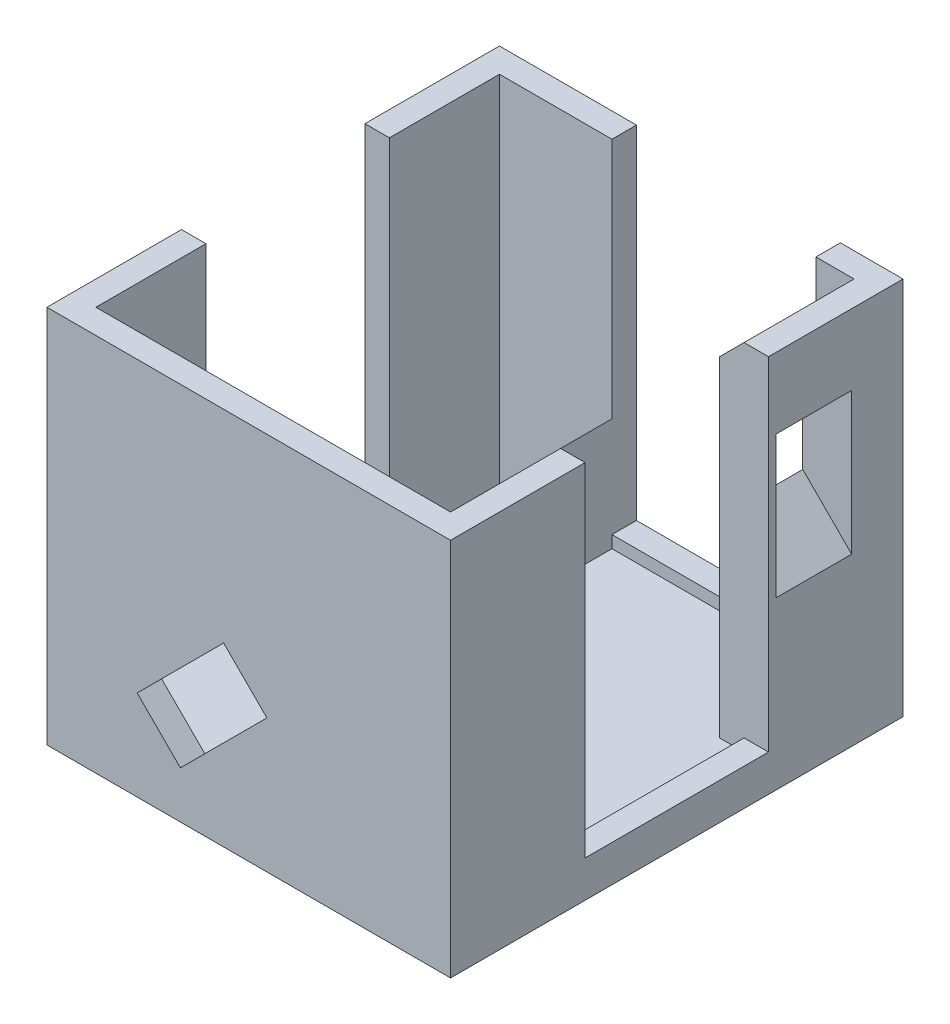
SolidWorks part; units mm, degrees
ref_plane "Front Plane" through (0, 0, 0) normal (0, 0, 1) x (1, 0, 0)
ref_plane "Top Plane" through (0, 0, 0) normal (0, 1, 0) x (1, 0, 0)
ref_plane "Right Plane" through (0, 0, 0) normal (1, 0, 0) x (0, 0, -1)
sketch "Sketch1" plane through (0, 0, 0) normal (0, 1, 0) x (1, 0, 0)
  line L1 (-29, 33) -> (29, 33)
  line L2 (-29, 33) -> (-29, -33)
  line L3 (-29, -33) -> (29, -33)
  line L4 (29, 33) -> (29, -33)
  line L5 (-29, 33) -> (29, -33) construction
  line L6 (-29, -33) -> (29, 33) construction
  line L7 (-33, 37) -> (33, 37)
  line L8 (-33, 37) -> (-33, -37)
  line L9 (-33, -37) -> (33, -37)
  line L10 (33, 37) -> (33, -37)
  line L11 (-33, 37) -> (33, -37) construction
  line L12 (-33, -37) -> (33, 37) construction
  point P0 (0, 0)
  point P6 (0, 0)
  dimension "D1" = 58
  dimension "D2" = 66
  dimension "D3" = 4
  dimension "D4" = 4
extrude "Boss-Extrude1" add sketch "Sketch1" along normal blind 58
sketch "Sketch2" plane through (0, 0, 0) normal (0, -1, 0) x (1, 0, 0)
  line L1 (-33, -37) -> (33, -37)
  line L2 (-33, -37) -> (-33, 37)
  line L3 (-33, 37) -> (33, 37)
  line L4 (33, -37) -> (33, 37)
  line L5 (-33, -37) -> (33, 37) construction
  line L6 (-33, 37) -> (33, -37) construction
  point P0 (0, 0)
extrude "Boss-Extrude2" add sketch "Sketch2" along normal blind 4
sketch "Sketch7" plane through (0, 0, 37) normal (0, 0, 1) x (1, 0, 0)
  line L0 (-29, 0) -> (29, 0)
  line L2 (-33, 58) -> (-33, -4) construction
  line L3 (-29, 0) -> (29, 58)
  line L6 (33, 58) -> (33, -4) construction
  line L7 (29, 58) -> (29, 0)
  dimension "D1" = 4
  dimension "D2" = 45
  dimension "D3" = 4
  dimension "D4" = 4
extrude "Boss-Extrude4" add sketch "Sketch7" against normal blind 70
sketch "Sketch9" plane through (-14.5, 14.5, 0) normal (-0.7071, 0.7071, 0) x (0, 0, 1)
  line L2 (-33, 61.5183) -> (-33, -20.5061) construction
  line L3 (-28.6, 56.1593) -> (-16.2, 56.1593)
  line L4 (-28.6, 56.1593) -> (-28.6, 39.7593)
  line L5 (-28.6, 39.7593) -> (-16.2, 39.7593)
  line L6 (-16.2, 56.1593) -> (-16.2, 39.7593)
  line L7 (-28.6, 56.1593) -> (-16.2, 39.7593) construction
  line L8 (-28.6, 39.7593) -> (-16.2, 56.1593) construction
  dimension "D1" = 12.4
  dimension "D2" = 16.4
  dimension "D3" = 4.4
extrude "Cut-Extrude3" cut sketch "Sketch9" against normal blind 30
sketch "Sketch11" plane through (0, 0, 37) normal (0, 0, 1) x (1, 0, 0)
  line L0 (-29, 0) -> (-2.6603, 0)
  line L1 (-29, 0) -> (-18.252, 10.748)
  line L2 (-33, 58) -> (-33, -4) construction
  line L3 (33, -4) -> (-33, -4) construction
  line L4 (-18.252, 10.748) -> (-4.1098, 24.8902)
  line L8 (-4.1098, 24.8902) -> (2.9612, 17.8191)
  line L9 (-18.252, 10.748) -> (-11.1809, 3.677)
  line L10 (-11.1809, 3.677) -> (2.9612, 17.8191)
  dimension "D1" = 4
  dimension "D2" = 4
  dimension "D3" = 15.2
  dimension "D4" = 45
  dimension "D5" = 20
  dimension "D6" = 10
  dimension "D7" = 10
extrude "Cut-Extrude7" cut sketch "Sketch11" against normal blind 5 contours L9 L10 L8 L4
sketch "Sketch8" plane through (0, 0, 0) normal (0, 1, 0) x (1, 0, 0)
  line L0 (-29, -27) -> (-26.2, -27)
  line L2 (-29, 33) -> (-29, -33) construction
  line L5 (-26.2, -27) -> (-26.2, -33)
  line L7 (-29, -33) -> (29, -33) construction
  line L9 (-10.6, 33) -> (-10.6, 21)
  line L11 (29, 33) -> (-29, 33) construction
  line L12 (-10.6, 21) -> (-29, 21)
  line L13 (-29, 33) -> (-29, -33) construction
  line L14 (29, -15) -> (25, -15)
  line L15 (29, -33) -> (29, 33) construction
  line L16 (25, -15) -> (25, -33)
  line L17 (29, 15) -> (25, 15)
  line L18 (25, 15) -> (25, 33)
  line L19 (-10.6, 33) -> (25, 33)
  line L20 (29, 15) -> (29, -15)
  line L21 (25, -33) -> (-26.2, -33)
  line L22 (-29, -27) -> (-29, 21)
  dimension "D1" = 2.8
  dimension "D2" = 6
  dimension "D3" = 18.4
  dimension "D4" = 12
  dimension "D5" = 4
  dimension "D6" = 18
  dimension "D7" = 4
  dimension "D8" = 18
extrude "Cut-Extrude2" cut sketch "Sketch8" along normal blind 70 contours L22 L12 L9 L19 L18 L17 L20 L14 L16 L21 L5 L0
sketch "Sketch12" plane through (0, 58, 0) normal (0, 1, 0) x (1, 0, 0)
  line L6 (29, 15) -> (33, 15)
  line L7 (33, -37) -> (33, 37) construction
  line L8 (33, 15) -> (33, -15)
  line L9 (33, -15) -> (29, -15)
  line L10 (29, -15) -> (29, 15)
  line L11 (0, 0) -> (0, 24.5813) construction
  line L12 (-33, -15) -> (-29, -15)
  line L13 (-33, 15) -> (-33, -15)
  line L14 (-29, 15) -> (-33, 15)
  line L15 (-29, -15) -> (-29, 15)
extrude "Cut-Extrude8" cut sketch "Sketch12" against normal blind 56
sketch "Sketch15" plane through (0, 0, 0) normal (0, 1, 0) x (1, 0, 0)
  circle A0 centre (0, 0) radius 10
  dimension "D1" = 20
extrude "Boss-Extrude5" add sketch "Sketch15" along normal blind 18.4
sketch "Sketch14" plane through (0, 0, 0) normal (0, 1, 0) x (1, 0, 0)
  line L0 (2.23, -1.6092) -> (2.23, 1.6092)
  arc A1 (2.23, 1.6092) -> (2.23, -1.6092) centre (0, 0) ccw
  point P6 (2.23, 0)
  point P7 (0, 0)
  dimension "D2" = 2.75
extrude "Cut-Extrude9" cut sketch "Sketch14" against normal blind 4 and the other way blind 18.4
sketch "Sketch16" plane through (0, 58, 0) normal (0, 1, 0) x (1, 0, 0)
  line L0 (33, 37) -> (-33, 37) construction
  line L1 (-10.6, 33) -> (22.7549, 33)
  line L2 (-10.6, 33) -> (-10.6, 37)
  line L3 (-10.6, 37) -> (22.7549, 37)
  line L4 (22.7549, 33) -> (22.7549, 37)
extrude "Cut-Extrude10" cut sketch "Sketch16" against normal blind 56
